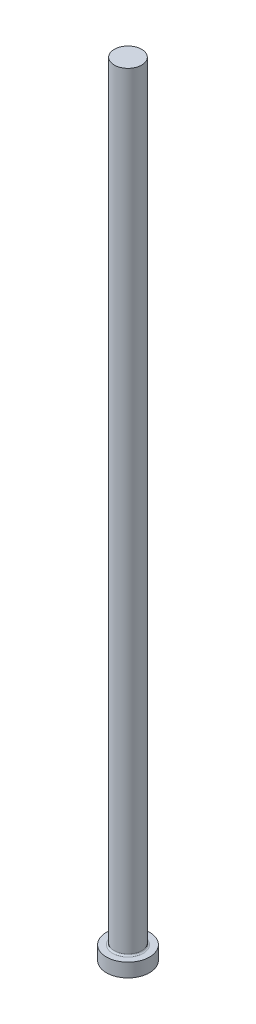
SolidWorks part; units mm, degrees
ref_plane "Plano frontal" through (0, 0, 0) normal (0, 0, 1) x (1, 0, 0)
ref_plane "Plano superior" through (0, 0, 0) normal (0, 1, 0) x (1, 0, 0)
ref_plane "Plano direito" through (0, 0, 0) normal (1, 0, 0) x (0, 0, -1)
sketch "Esboço1" plane through (0, 0, 0) normal (0, 0, 1) x (1, 0, 0)
  line L0 (0, 0) -> (11, 0)
  line L1 (11, 0) -> (11, 7)
  line L2 (11, 7) -> (7.8, 7)
  line L3 (7, 7.8) -> (7, 400)
  line L4 (7, 400) -> (0, 400)
  line L5 (0, 400) -> (0, 0) construction
  line L6 (0, 0) -> (0, 400)
  arc A0 (7.8, 7) -> (7, 7.8) centre (7.8, 7.8) cw
  dimension "D3" = 0.8
  dimension "D1" = 22
  dimension "D2" = 14
  dimension "D4" = 7
  dimension "D5" = 400
revolve "Revolução1" add sketch "Esboço1" angle 360 about L5
sketch "Esboço2"
  dimension "D1" = 0.825
  dimension "D2" = 1.925
  dimension "D3" = 1.2375
  dimension "D4" = 5.9125
wrap "Envolver1" sketch "Esboço2" wrap type deboss source sketch "Esboço2" thickness 0.1 parameters "D1"=0.1
